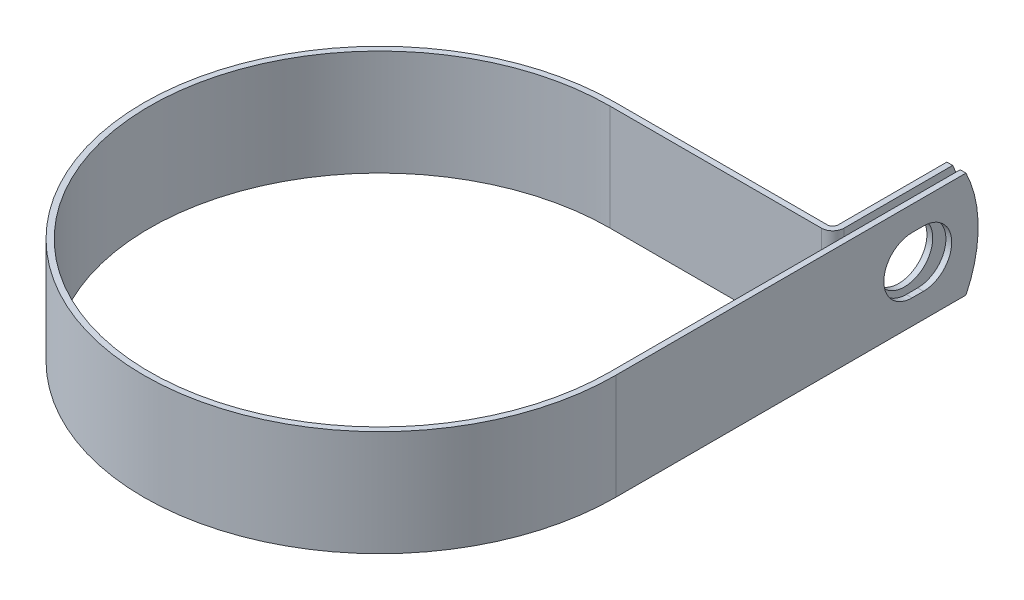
SolidWorks part; units mm, degrees
ref_plane "Front Plane" through (0, 0, 0) normal (0, 0, 1) x (1, 0, 0)
ref_plane "Top Plane" through (0, 0, 0) normal (0, 1, 0) x (1, 0, 0)
ref_plane "Right Plane" through (0, 0, 0) normal (1, 0, 0) x (0, 0, -1)
sketch "Sketch1" plane through (0, 0, 0) normal (0, 1, 0) x (1, 0, 0)
  line L0 (0, 48.4124) -> (44.4602, 48.4124)
  line L1 (48.4124, 0) -> (48.4124, 48.4124)
  line L2 (46.8376, 76.2) -> (46.8376, 50.7898)
  line L5 (48.4124, 48.4124) -> (48.4124, 76.2)
  arc A0 (0, 48.4124) -> (48.4124, 0) centre (0, 0) ccw
  arc A3 (44.4602, 48.4124) -> (46.8376, 50.7898) centre (44.4602, 50.7898) ccw
extrude "Extrude-Thin1" add sketch "Sketch1" along normal mid plane 22.225 thin
sketch "Sketch2" plane through (45.6184, 0, 0) normal (-1, 0, 0) x (0, 0, 1)
  line L0 (-76.2, 11.1125) -> (-76.2, -11.1125) construction
  line L7 (0, 11.1125) -> (0, -11.1125) construction
  circle A0 centre (-63.5, 0) radius 5.9436
  point P2 (-76.2, 0)
extrude "Cut-Extrude1" cut sketch "Sketch2" against normal up to surface (1.2192 mm away)
sketch "Sketch3" plane through (49.6316, 0, 0) normal (1, 0, 0) x (0, 0, -1)
  line L0 (62.3062, 0) -> (64.6938, 0) construction
  line L1 (62.3062, 5.9436) -> (64.6938, 5.9436)
  line L2 (62.3062, -5.9436) -> (64.6938, -5.9436)
  line L3 (76.2, 11.1125) -> (76.2, -11.1125) construction
  arc A0 (62.3062, 5.9436) -> (62.3062, -5.9436) centre (62.3062, 0) ccw
  arc A1 (64.6938, -5.9436) -> (64.6938, 5.9436) centre (64.6938, 0) ccw
  point P3 (63.5, 0)
  point P8 (76.2, 0)
  point P11 (56.3626, 0)
  point P12 (70.6374, 0)
extrude "Cut-Extrude2" cut sketch "Sketch3" against normal up to surface (1.2192 mm away)
sketch "Sketch4" plane through (45.6184, 0, 0) normal (-1, 0, 0) x (0, 0, 1)
  line L0 (-76.2, 11.1125) -> (-76.2, -11.1125)
  line L1 (-76.2, 11.1125) -> (-73.6401, 11.1125)
  line L2 (-76.2, 11.1125) -> (-50.7898, 11.1125) construction
  line L3 (-76.2, -11.1125) -> (-73.6401, -11.1125)
  line L4 (-76.2, -11.1125) -> (-50.7898, -11.1125) construction
  arc A0 (-73.6401, 11.1125) -> (-73.6401, -11.1125) centre (-50.8, 0) ccw
extrude "Cut-Extrude3" cut sketch "Sketch4" against normal through all contours A0 M4 M5 | A0 L0 M2
equation "\"D1@Sketch3\" = \"D2@Sketch2\""
equation "\"D7@Sketch1\" = \"D3@Sketch2\" + \"D1@Sketch3\""
equation "\"D1@Sketch4\" = ( \"D1@Extrude-Thin1\" + .125 ) * 2"
equation "\"D2@Sketch1\"=1.95*\"D5@Extrude-Thin1\""
equation "\"D2@Sketch3\" = \"D1@Sketch2\""
